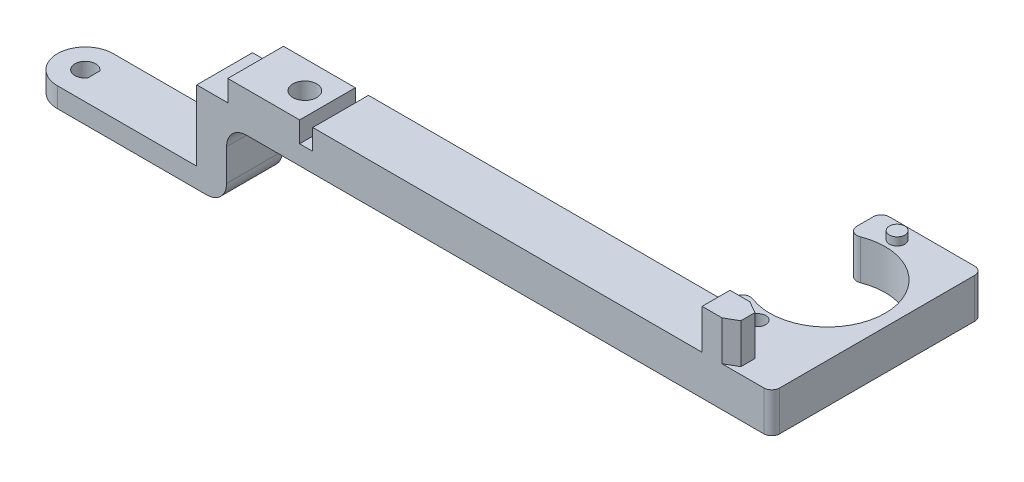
SolidWorks part; units mm, degrees
ref_plane "Front Plane" through (0, 0, 0) normal (0, 0, 1) x (1, 0, 0)
ref_plane "Top Plane" through (0, 0, 0) normal (0, 1, 0) x (1, 0, 0)
ref_plane "Right Plane" through (0, 0, 0) normal (1, 0, 0) x (0, 0, -1)
sketch "Sketch1" plane through (0, 0, 0) normal (0, 0, 1) x (1, 0, 0)
  line L3 (49.5, 18) -> (186.5, 18)
  line L4 (186.5, 18) -> (186.5, 28)
  line L5 (186.5, 28) -> (71.15, 28)
  line L6 (49.5, 18) -> (49.5, 0)
  line L7 (49.5, 0) -> (0, 0)
  line L8 (0, 0) -> (0, 5)
  line L9 (0, 5) -> (42, 5)
  line L10 (42, 5) -> (42, 23) construction
  line L13 (49.8, 22.7) -> (49.8, 28)
  line L14 (67.85, 28) -> (67.85, 22.8)
  line L15 (67.85, 22.8) -> (71.15, 22.8)
  line L16 (71.15, 22.8) -> (71.15, 28)
  line L17 (67.85, 28) -> (49.8, 28)
  line L18 (42, 5) -> (42, 22.7)
  line L19 (42, 22.7) -> (49.8, 22.7)
  line L20 (7, 0) -> (7, 5) construction
  line L21 (177, 28) -> (177, 18) construction
  point P13 (186.5, 23)
  point P14 (42, 14)
  point P15 (69.5, 22.8)
  dimension "D1" = 5
  dimension "D2" = 3.3
  dimension "D3" = 20
  dimension "D4" = 18
  dimension "D5" = 10
  dimension "D6" = 7.5
  dimension "D7" = 5.2
  dimension "D8" = 42
  dimension "D9" = 0.3
  dimension "D10" = 0.3
  dimension "D11" = 7
  dimension "D12" = 170
  dimension "D13" = 9.5
extrude "Boss-Extrude1" add sketch "Sketch1" along normal blind 14
sketch "Sketch2" plane through (0, 28, 0) normal (0, 1, 0) x (1, 0, 0)
  line L0 (0, -7) -> (186.5, -7) construction
  line L1 (0, -14) -> (0, 0) construction
  line L2 (186.5, -14) -> (186.5, 0) construction
  line L4 (71.15, -14) -> (71.15, 0) construction
  circle A0 centre (62.15, -7) radius 3
  dimension "D1" = 6
  dimension "D2" = 9
extrude "Cut-Extrude1" cut sketch "Sketch2" against normal blind 21
sketch "Sketch3" plane through (0, 5, 0) normal (0, 1, 0) x (1, 0, 0)
  line L0 (9, -5.5) -> (9, -8.5) construction
  line L1 (0, -7) -> (42, -7) construction
  line L2 (0, -14) -> (0, 0) construction
  line L3 (42, -14) -> (42, 0) construction
  line L4 (0, -7) -> (0, 0)
  line L5 (0, 0) -> (7, 0)
  line L6 (7, -14) -> (0, -14.0023)
  line L7 (0, -14.0023) -> (0, -7)
  line L8 (9.1, -5.467) -> (9.1, -8.533)
  arc A0 (9, -5.5) -> (9, -8.5) centre (7, -7) ccw construction
  arc A1 (7, 0) -> (7, -14) centre (7, -7) ccw
  arc A2 (9.1, -5.467) -> (9.1, -8.533) centre (7, -7) ccw
  point P4 (4.5, -7)
  dimension "D1" = 5
  dimension "D2" = 4.5
  dimension "D3" = 7
  dimension "D4" = 0.1
extrude "Cut-Extrude2" cut sketch "Sketch3" against normal blind 8 contours A1 M2 M3 | A1 M3 M4 | L1 A0 L0 | A0 L1 L0 | L8 A2
sketch "Sketch6" plane through (0, 28, 0) normal (0, 1, 0) x (1, 0, 0)
  line L1 (186.5, 17.5) -> (186.5, 39)
  line L2 (186.5, 39) -> (161, 39)
  line L3 (161, 39) -> (161, 29.5934)
  line L4 (186.5, 17.5) -> (186.5, 0)
  line L5 (186.5, 0) -> (161, 0)
  line L6 (186.5, 0) -> (71.15, 0) construction
  line L7 (161, 0) -> (161, 5.4066)
  arc A0 (161, 5.4066) -> (161, 29.5934) centre (169, 17.5) ccw
  circle A1 centre (169, 0) radius 2
  circle A2 centre (169, 35) radius 2
  point P2 (186.5, 17.5)
  point P24 (183.5, 17.5)
  dimension "D1" = 29
  dimension "D2" = 4
  dimension "D4" = 4
  dimension "D3" = 17.5
  dimension "D5" = 17.5
  dimension "D6" = 3
  dimension "D7" = 8
  dimension "D8" = 4
extrude "Boss-Extrude2" add sketch "Sketch6" against normal blind 10 contours L2 L3 A0 L7 L5 L4 L1
sketch "Sketch7" plane through (0, 28, 0) normal (0, 1, 0) x (1, 0, 0)
  arc A0 (161, 5.4066) -> (161, 29.5934) centre (169, 17.5) ccw construction
  arc A1 (161, 5.4066) -> (161, 29.5934) centre (169, 17.5) ccw construction
  circle A2 centre (169, 35) radius 1.95
  dimension "D1" = 3.9
  dimension "D2" = 17.5
extrude "Boss-Extrude3" add sketch "Sketch7" along normal blind 2
sketch "Sketch8" plane through (0, 28, 0) normal (0, 1, 0) x (1, 0, 0)
  arc A0 (161, 5.4066) -> (161, 29.5934) centre (169, 17.5) ccw construction
  arc A1 (161, 5.4066) -> (161, 29.5934) centre (169, 17.5) ccw construction
  circle A2 centre (169, 0) radius 2
  arc A3 (7, 0) -> (7, -14) centre (7, -7) ccw construction
  point P5 (0, -7)
  dimension "D1" = 4
  dimension "D2" = 17.5
extrude "Cut-Extrude3" cut sketch "Sketch8" against normal blind 32
fillet "Fillet1" radius 2 6 edges at (186.5, 23, 14) (186.5, 23, -39) (161, 23, -39) (161, 23, 0) (161, 23, -5.4066) (161, 23, -29.5934)
fillet "Fillet2" radius 5 2 edges at (49.5, 0, 7) (49.5, 18, 7)
sketch "Sketch9" plane through (0, 28, 0) normal (0, 1, 0) x (1, 0, 0)
  line L0 (159, 0) -> (71.15, 0) construction
  line L1 (78.3323, 0) -> (99.5383, 0)
  line L2 (78.3323, 0) -> (78.3323, -7)
  line L3 (78.3323, -7) -> (99.5383, -7)
  line L4 (99.5383, 0) -> (99.5383, -7)
  arc A0 (7, 0) -> (7, -14) centre (7, -7) ccw construction
  point P6 (0, -7)
extrude "Boss-Extrude4" [suppressed] add sketch "Sketch9" along normal blind 10
sketch "Sketch10" plane through (0, 28, 0) normal (0, 1, 0) x (1, 0, 0)
  line L1 (184.5, -14) -> (71.15, -14) construction
  line L2 (169, -7) -> (169, -14)
  line L3 (169, -14) -> (174, -14)
  line L4 (174, -14) -> (177, -12.2679)
  line L5 (177, -12.2679) -> (177, -8.7321)
  line L6 (177, -8.7321) -> (174, -7)
  line L7 (174, -7) -> (169, -7)
  arc A0 (163.7273, 3.9927) -> (163.7273, 31.0073) centre (169, 17.5) ccw construction
  arc A1 (163.7273, 3.9927) -> (163.7273, 31.0073) centre (169, 17.5) ccw construction
  point P8 (169, -10.5)
  point P13 (177, -10.5)
  dimension "D1" = 30
  dimension "D2" = 7
  dimension "D3" = 3
  dimension "D4" = 5
  dimension "D5" = 8
extrude "Boss-Extrude5" add sketch "Sketch10" along normal blind 10 contours L7 L2 L3 L4 L5 L6
